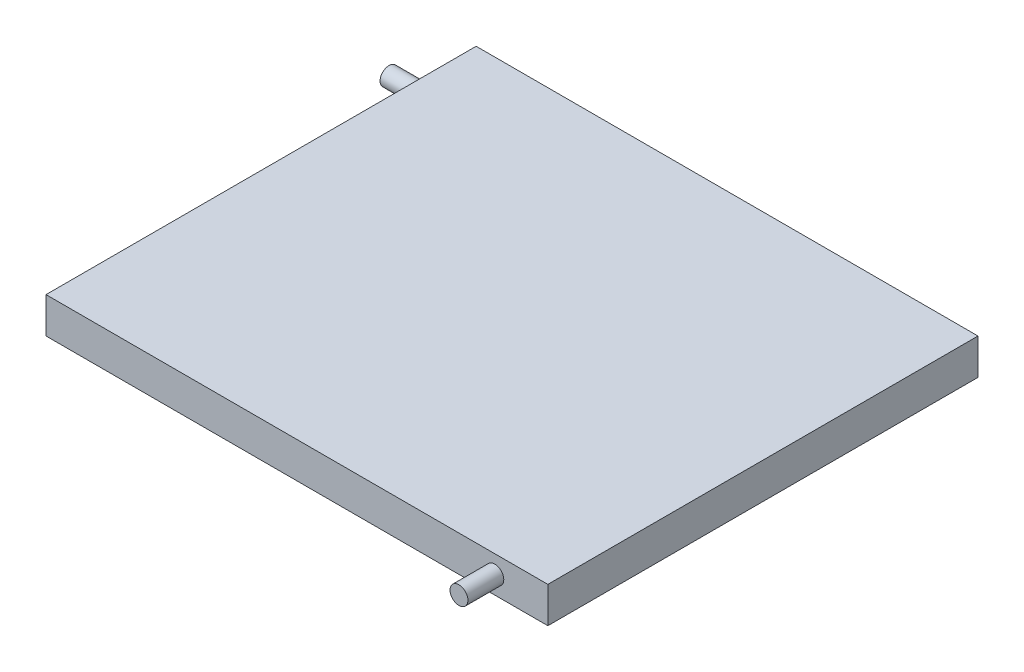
SolidWorks part; units mm, degrees
ref_plane "Front Plane" through (0, 0, 0) normal (0, 0, 1) x (1, 0, 0)
ref_plane "Top Plane" through (0, 0, 0) normal (0, 1, 0) x (1, 0, 0)
ref_plane "Right Plane" through (0, 0, 0) normal (1, 0, 0) x (0, 0, -1)
sketch "Sketch1" plane through (0, 0, 0) normal (0, 1, 0) x (1, 0, 0)
  line L1 (0, 0) -> (355.6, 0)
  line L2 (0, 0) -> (0, 304.8)
  line L3 (0, 304.8) -> (355.6, 304.8)
  line L4 (355.6, 0) -> (355.6, 304.8)
  dimension "D1" = 304.8
  dimension "D2" = 355.6
extrude "Extrude1" add sketch "Sketch1" against normal mid plane 25.4
sketch "Sketch2" plane through (0, 0, 0) normal (0, 1, 0) x (1, 0, 0)
  line L0 (-25.4, 268.4599) -> (171.9291, 268.4599)
  line L1 (171.9291, 243.0599) -> (42.6084, 243.0599)
  line L2 (42.6084, 217.6599) -> (171.9291, 217.6599)
  line L3 (171.9291, 192.2599) -> (42.6084, 192.2599)
  line L4 (171.9291, 166.8599) -> (42.6084, 166.8599)
  line L5 (42.6084, 141.4599) -> (171.9291, 141.4599)
  line L6 (42.6084, 116.0599) -> (203.7287, 116.0599)
  line L7 (216.4287, 103.3599) -> (216.4287, 33.5065)
  line L8 (241.8287, 33.5065) -> (241.8287, 103.3599)
  line L9 (267.2287, 103.3599) -> (267.2287, 33.5065)
  line L10 (292.6287, 33.5065) -> (292.6287, 103.3599)
  line L11 (318.0287, 103.3599) -> (318.0287, -25.4)
  line L12 (0, 304.8) -> (0, 0) construction
  line L13 (0, 0) -> (355.6, 0) construction
  arc A0 (171.9291, 268.4599) -> (171.9291, 243.0599) centre (171.9291, 255.7599) cw
  arc A1 (42.6084, 243.0599) -> (42.6084, 217.6599) centre (42.6084, 230.3599) ccw
  arc A2 (171.9291, 217.6599) -> (171.9291, 192.2599) centre (171.9291, 204.9599) cw
  arc A3 (42.6084, 192.2599) -> (42.6084, 166.8599) centre (42.6084, 179.5599) ccw
  arc A4 (171.9291, 166.8599) -> (171.9291, 141.4599) centre (171.9291, 154.1599) cw
  arc A5 (42.6084, 141.4599) -> (42.6084, 116.0599) centre (42.6084, 128.7599) ccw
  arc A6 (203.7287, 116.0599) -> (216.4287, 103.3599) centre (203.7287, 103.3599) cw
  arc A7 (216.4287, 33.5065) -> (241.8287, 33.5065) centre (229.1287, 33.5065) ccw
  arc A8 (241.8287, 103.3599) -> (267.2287, 103.3599) centre (254.5287, 103.3599) cw
  arc A9 (267.2287, 33.5065) -> (292.6287, 33.5065) centre (279.9287, 33.5065) ccw
  arc A10 (292.6287, 103.3599) -> (318.0287, 103.3599) centre (305.3287, 103.3599) cw
  dimension "D3" = 12.7
  dimension "D1" = 25.4
  dimension "D2" = 25.4
ref_plane "Plane1" through (318.0287, 0, 25.4) normal (0, 0, 1) x (1, 0, 0)
sketch "Sketch3" plane through (318.0287, 0, 25.4) normal (0, 0, 1) x (1, 0, 0)
  circle A0 centre (0, 0) radius 6.35
  dimension "D1" = 12.7
sweep "Sweep1" add profiles "Sketch3" path "Sketch2"
